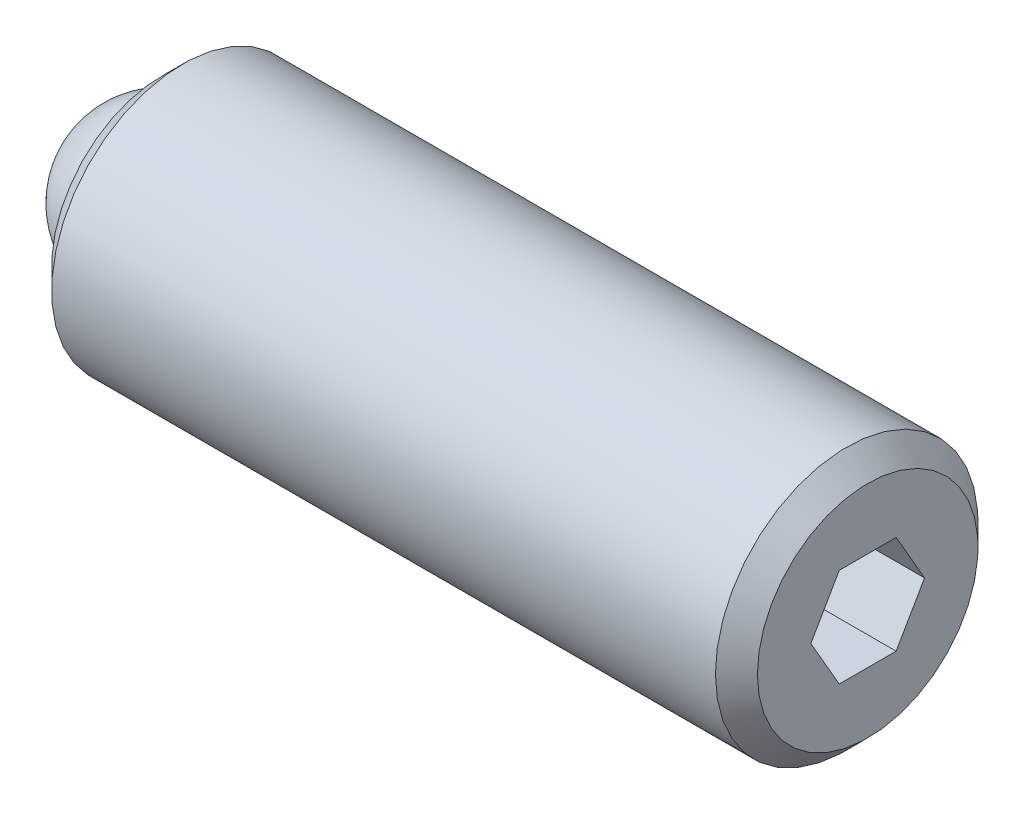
SolidWorks part; units mm, degrees
ref_plane "Front Plane" through (0, 0, 0) normal (0, 0, 1) x (1, 0, 0)
ref_plane "Top Plane" through (0, 0, 0) normal (0, 1, 0) x (1, 0, 0)
ref_plane "Right Plane" through (0, 0, 0) normal (1, 0, 0) x (0, 0, -1)
sketch "Sketch2" plane through (0, 0, 0) normal (1, 0, 0) x (0, 0, -1)
  circle A0 centre (0, 0) radius 3.175
  dimension "D1" = 6.35
extrude "Boss-Extrude1" add sketch "Sketch2" along normal blind 17.0656
sketch "Sketch3" plane through (0, 0, 0) normal (-1, 0, 0) x (0, 0, 1)
  circle A0 centre (0, 0) radius 1.9812
  dimension "D1" = 3.9624
chamfer "Chamfer1" distance 0.508 angle 45 1 edges at (0, 0, -3.175)
chamfer "Chamfer2" distance 0.508 angle 45 1 edges at (17.0656, 0, -3.175)
sketch "Sketch4" plane through (17.0656, 0, 0) normal (1, 0, 0) x (0, 0, -1)
  line L1 (1.3748, 0) -> (0.6874, 1.1906)
  line L2 (0.6874, 1.1906) -> (-0.6874, 1.1906)
  line L3 (-0.6874, 1.1906) -> (-1.3748, 0)
  line L4 (-1.3748, 0) -> (-0.6874, -1.1906)
  line L5 (-0.6874, -1.1906) -> (0.6874, -1.1906)
  line L6 (0.6874, -1.1906) -> (1.3748, 0)
  circle A0 centre (0, 0) radius 1.1906 construction
  dimension "D1" = 2.3813
extrude "Cut-Extrude2" cut sketch "Sketch4" against normal blind 2.286
extrude "Cut-Extrude3" cut sketch "Sketch3" against normal blind 1.9844
sketch "Sketch5" plane through (0, 0, 0) normal (-1, 0, 0) x (0, 0, 1)
  line L0 (0, 0) -> (0, -1.9844)
  line L1 (0, 0) -> (0, 1.9844)
  arc A0 (0, 1.9844) -> (0, -1.9844) centre (0, 0) ccw
  dimension "D1" = 1.9844
revolve "Revolve1" add sketch "Sketch5" angle 360 about L1
sketch "Sketch6" plane through (0, 0, 0) normal (-1, 0, 0) x (0, 0, 1)
  line L0 (0, 0) -> (0, 1.9812) construction
  circle A0 centre (0, 0) radius 1.9812 construction
  arc A1 (0.0635, 1.9802) -> (-0.0635, 1.9802) centre (0, 0) ccw
  arc A2 (0.0635, 1.9802) -> (-0.0635, 1.9802) centre (0, 1.9812) ccw
  dimension "D1" = 0.127
extrude "Cut-Extrude4" cut sketch "Sketch6" against normal up to surface (1.9844 mm away) contours A2 A1
